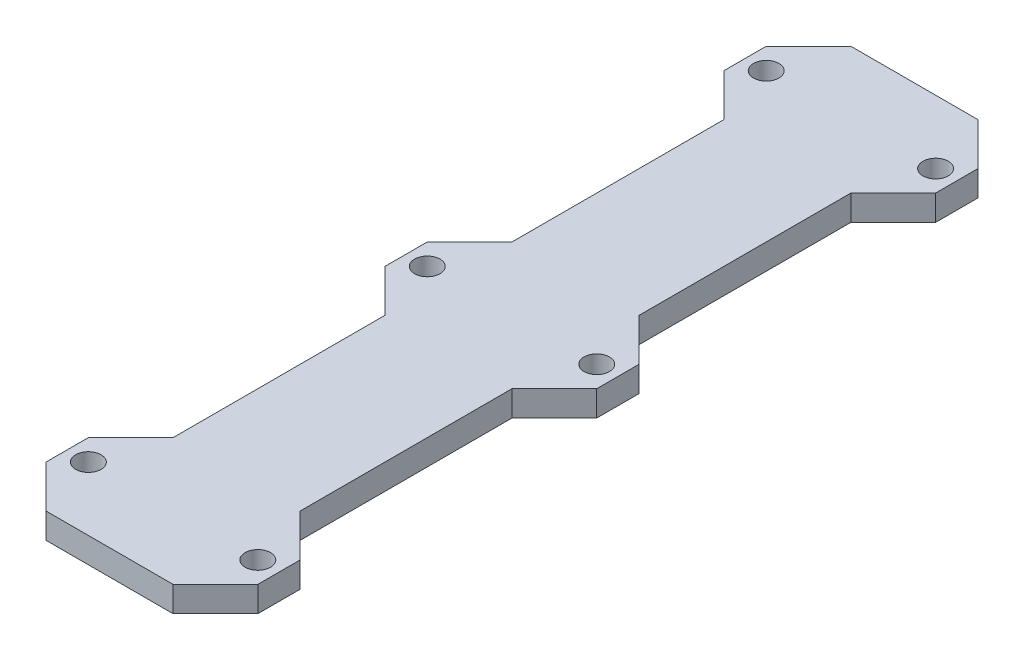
SolidWorks part; units mm, degrees
ref_plane "Alzado" through (0, 0, 0) normal (0, 0, 1) x (1, 0, 0)
ref_plane "Planta" through (0, 0, 0) normal (0, 1, 0) x (1, 0, 0)
ref_plane "Vista lateral" through (0, 0, 0) normal (1, 0, 0) x (0, 0, -1)
sketch "Croquis1" plane through (0, 0, 0) normal (0, 1, 0) x (1, 0, 0)
  line L0 (0, 0) -> (50000, 0) construction
  line L1 (-7.5, 75) -> (7.5, 75) construction
  line L2 (-7.5, 75) -> (-7.5, -75) construction
  line L3 (-7.5, -75) -> (7.5, -75) construction
  line L4 (7.5, 75) -> (7.5, -75) construction
  line L5 (-7.5, 75) -> (7.5, -75) construction
  line L6 (-7.5, -75) -> (7.5, 75) construction
  line L7 (-12.5, -2.5) -> (-12.5, 2.5)
  line L8 (-12.5, 2.5) -> (-7.5, 7.5)
  line L9 (-12.5, -2.5) -> (-7.5, -7.5)
  line L10 (-7.5, -7.5) -> (-7.5, 7.5) construction
  line L11 (0, 0) -> (0, 50000) construction
  line L12 (-12.5, -37.5) -> (-7.5, -32.5)
  line L13 (-12.5, -42.5) -> (-12.5, -37.5)
  line L14 (-12.5, -42.5) -> (-7.5, -47.5)
  line L15 (-12.5, 37.5) -> (-7.5, 32.5)
  line L16 (-12.5, 37.5) -> (-12.5, 42.5)
  line L17 (-12.5, 42.5) -> (-7.5, 47.5)
  line L18 (12.5, -42.5) -> (12.5, -37.5)
  line L19 (12.5, -42.5) -> (7.5, -47.5)
  line L20 (12.5, -37.5) -> (7.5, -32.5)
  line L21 (12.5, -2.5) -> (7.5, -7.5)
  line L22 (12.5, -2.5) -> (12.5, 2.5)
  line L23 (12.5, 2.5) -> (7.5, 7.5)
  line L24 (12.5, 37.5) -> (7.5, 32.5)
  line L25 (12.5, 37.5) -> (12.5, 42.5)
  line L26 (12.5, 42.5) -> (7.5, 47.5)
  line L27 (-7.5, -47.5) -> (7.5, -47.5)
  line L28 (7.5, -32.5) -> (7.5, -7.5)
  line L29 (7.5, 7.5) -> (7.5, 32.5)
  line L30 (7.5, 47.5) -> (-7.5, 47.5)
  line L31 (-7.5, 32.5) -> (-7.5, 7.5)
  line L32 (-7.5, -7.5) -> (-7.5, -32.5)
  line L33 (10, 40) -> (12.5, 40) construction
  circle A0 centre (10, 40) radius 1.5
  circle A1 centre (10, 0) radius 1.5
  circle A2 centre (10, -40) radius 1.5
  circle A3 centre (-10, -40) radius 1.5
  circle A4 centre (-10, 40) radius 1.5
  circle A5 centre (-10, 0) radius 1.5
  point P0 (0, 0)
  point P10 (-12.5, 0)
  dimension "D11" = 3
  dimension "D1" = 150
  dimension "D2" = 15
  dimension "D3" = 15
  dimension "D4" = 45
  dimension "D5" = 5
  dimension "D7" = 40
  dimension "D9" = 40
  dimension "D10" = 2.5
  dimension "D6" = 2
  dimension "D8" = 2
  dimension "D12" = 3
extrude "Saliente-Extruir1" add sketch "Croquis1" along normal blind 3
